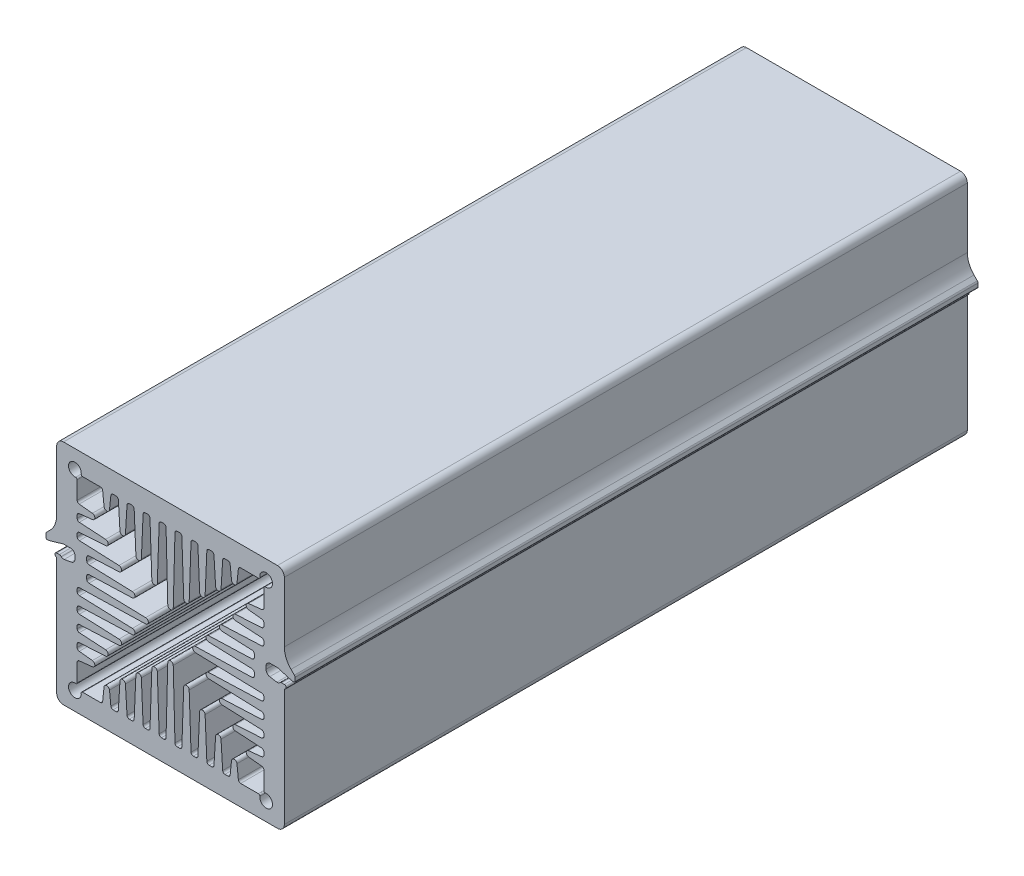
SolidWorks part; units mm, degrees
ref_plane "Front Plane" through (0, 0, 0) normal (0, 0, 1) x (1, 0, 0)
ref_plane "Top Plane" through (0, 0, 0) normal (0, 1, 0) x (1, 0, 0)
ref_plane "Right Plane" through (0, 0, 0) normal (1, 0, 0) x (0, 0, -1)
ref_plane "Plane1" through (0, 0, 0) normal (0, 0, -1) x (-1, 0, 0)
sketch "Sketch1" plane through (0, 0, 0) normal (0, 0, -1) x (-1, 0, 0)
  line L0 (-44.3118, 45.5) -> (-40.3993, 45.5)
  line L1 (-39.902, 45.0523) -> (-39.5967, 42.1473)
  line L2 (-38.4033, 42.1473) -> (-38.098, 45.0523)
  line L3 (-37.6007, 45.5) -> (-36.9519, 45.5)
  line L4 (-36.4528, 45.0305) -> (-36.0989, 39.2434)
  line L5 (-34.9011, 39.2434) -> (-34.5472, 45.0305)
  line L6 (-34.0481, 45.5) -> (-33.4792, 45.5)
  line L7 (-32.9796, 45.0218) -> (-32.5994, 36.3138)
  line L8 (-31.4006, 36.3138) -> (-31.0204, 45.0218)
  line L9 (-30.5208, 45.5) -> (-30.0058, 45.5)
  line L10 (-29.5061, 45.0174) -> (-29.0996, 33.3791)
  line L11 (-27.9004, 33.3791) -> (-27.4939, 45.0174)
  line L12 (-26.9942, 45.5) -> (-26.4807, 45.5)
  line L13 (-25.9809, 45.0131) -> (-25.5998, 30.4593)
  line L14 (-24.4002, 30.4593) -> (-24.0191, 45.0131)
  line L15 (-23.5193, 45.5) -> (-23.0058, 45.5)
  line L16 (-22.5061, 45.0174) -> (-22.0996, 33.3791)
  line L17 (-20.9004, 33.3791) -> (-20.4939, 45.0174)
  line L18 (-19.9942, 45.5) -> (-19.4792, 45.5)
  line L19 (-18.9796, 45.0218) -> (-18.5994, 36.3138)
  line L20 (-17.4006, 36.3138) -> (-17.0204, 45.0218)
  line L21 (-16.5208, 45.5) -> (-15.9519, 45.5)
  line L22 (-15.4528, 45.0305) -> (-15.0989, 39.2434)
  line L23 (-13.9011, 39.2434) -> (-13.5472, 45.0305)
  line L24 (-13.0481, 45.5) -> (-12.3993, 45.5)
  line L25 (-11.902, 45.0523) -> (-11.5967, 42.1473)
  line L26 (-10.4033, 42.1473) -> (-10.098, 45.0523)
  line L27 (-9.6007, 45.5) -> (-5.6882, 45.5)
  line L28 (-4.5, 44.3118) -> (-4.5, 40.3982)
  line L29 (-4.9477, 39.901) -> (-7.8427, 39.5967)
  line L30 (-7.8427, 38.4033) -> (-4.9477, 38.099)
  line L31 (-4.5, 37.6018) -> (-4.5, 36.9519)
  line L32 (-4.9695, 36.4528) -> (-10.7566, 36.0989)
  line L33 (-10.7566, 34.9011) -> (-4.9695, 34.5472)
  line L34 (-4.5, 34.0481) -> (-4.5, 33.4792)
  line L35 (-4.9782, 32.9796) -> (-13.6862, 32.5994)
  line L36 (-13.6862, 31.4006) -> (-7.0782, 31.1121)
  line L37 (-6.6, 30.6125) -> (-6.6, 29.9324)
  line L38 (-7.0826, 29.4327) -> (-16.6209, 29.0996)
  line L39 (-16.6209, 27.9004) -> (-7.0826, 27.5673)
  line L40 (-6.6, 27.0676) -> (-6.6, 26.4257)
  line L41 (-7.0869, 25.9259) -> (-19.5407, 25.5998)
  line L42 (-19.5407, 24.4002) -> (-4.9869, 24.0191)
  line L43 (-4.5, 23.5193) -> (-4.5, 23.0058)
  line L44 (-4.9826, 22.5061) -> (-16.6209, 22.0996)
  line L45 (-16.6209, 20.9004) -> (-4.9826, 20.4939)
  line L46 (-4.5, 19.9942) -> (-4.5, 19.4792)
  line L47 (-4.9782, 18.9796) -> (-13.6862, 18.5994)
  line L48 (-13.6862, 17.4006) -> (-4.9782, 17.0204)
  line L49 (-4.5, 16.5208) -> (-4.5, 15.9519)
  line L50 (-4.9695, 15.4528) -> (-10.7566, 15.0989)
  line L51 (-10.7566, 13.9011) -> (-4.9695, 13.5472)
  line L52 (-4.5, 13.0481) -> (-4.5, 12.3982)
  line L53 (-4.9477, 11.901) -> (-7.8427, 11.5967)
  line L54 (-7.8427, 10.4033) -> (-4.9477, 10.099)
  line L55 (-4.5, 9.6018) -> (-4.5, 5.6882)
  line L56 (-5.6882, 4.5) -> (-9.6007, 4.5)
  line L57 (-10.098, 4.9477) -> (-10.4033, 7.8527)
  line L58 (-11.5967, 7.8527) -> (-11.902, 4.9477)
  line L59 (-12.3993, 4.5) -> (-13.0481, 4.5)
  line L60 (-13.5472, 4.9695) -> (-13.9011, 10.7566)
  line L61 (-15.0989, 10.7566) -> (-15.4528, 4.9695)
  line L62 (-15.9519, 4.5) -> (-16.5208, 4.5)
  line L63 (-17.0204, 4.9782) -> (-17.4006, 13.6862)
  line L64 (-18.5994, 13.6862) -> (-18.9796, 4.9782)
  line L65 (-19.4792, 4.5) -> (-19.9942, 4.5)
  line L66 (-20.4939, 4.9826) -> (-20.9004, 16.6209)
  line L67 (-22.0996, 16.6209) -> (-22.5061, 4.9826)
  line L68 (-23.0058, 4.5) -> (-23.5193, 4.5)
  line L69 (-24.0191, 4.9869) -> (-24.4002, 19.5407)
  line L70 (-25.5998, 19.5407) -> (-25.9809, 4.9869)
  line L71 (-26.4807, 4.5) -> (-26.9942, 4.5)
  line L72 (-27.4939, 4.9826) -> (-27.9004, 16.6209)
  line L73 (-29.0996, 16.6209) -> (-29.5061, 4.9826)
  line L74 (-30.0058, 4.5) -> (-30.5208, 4.5)
  line L75 (-31.0204, 4.9782) -> (-31.4006, 13.6862)
  line L76 (-32.5994, 13.6862) -> (-32.9796, 4.9782)
  line L77 (-33.4792, 4.5) -> (-34.0481, 4.5)
  line L78 (-34.5472, 4.9695) -> (-34.9011, 10.7566)
  line L79 (-36.0989, 10.7566) -> (-36.4528, 4.9695)
  line L80 (-36.9519, 4.5) -> (-37.6007, 4.5)
  line L81 (-38.098, 4.9477) -> (-38.4033, 7.8527)
  line L82 (-39.5967, 7.8527) -> (-39.902, 4.9477)
  line L83 (-40.3993, 4.5) -> (-44.3118, 4.5)
  line L84 (-45.5, 5.6882) -> (-45.5, 9.6018)
  line L85 (-45.0523, 10.099) -> (-42.1573, 10.4033)
  line L86 (-42.1573, 11.5967) -> (-45.0523, 11.901)
  line L87 (-45.5, 12.3982) -> (-45.5, 13.0481)
  line L88 (-45.0305, 13.5472) -> (-39.2434, 13.9011)
  line L89 (-39.2434, 15.0989) -> (-45.0305, 15.4528)
  line L90 (-45.5, 15.9519) -> (-45.5, 16.5208)
  line L91 (-45.0218, 17.0204) -> (-36.3138, 17.4006)
  line L92 (-36.3138, 18.5994) -> (-45.0218, 18.9796)
  line L93 (-45.5, 19.4792) -> (-45.5, 19.9942)
  line L94 (-45.0174, 20.4939) -> (-33.3791, 20.9004)
  line L95 (-33.3791, 22.0996) -> (-45.0174, 22.5061)
  line L96 (-45.5, 23.0058) -> (-45.5, 23.5193)
  line L97 (-45.0131, 24.0191) -> (-30.4593, 24.4002)
  line L98 (-30.4593, 25.5998) -> (-42.9131, 25.9259)
  line L99 (-43.4, 26.4257) -> (-43.4, 27.0676)
  line L100 (-42.9174, 27.5673) -> (-33.3791, 27.9004)
  line L101 (-33.3791, 29.0996) -> (-42.9174, 29.4327)
  line L102 (-43.4, 29.9324) -> (-43.4, 30.6125)
  line L103 (-42.9218, 31.1121) -> (-36.3138, 31.4006)
  line L104 (-36.3138, 32.5994) -> (-45.0218, 32.9796)
  line L105 (-45.5, 33.4792) -> (-45.5, 34.0481)
  line L106 (-45.0305, 34.5472) -> (-39.2434, 34.9011)
  line L107 (-39.2434, 36.0989) -> (-45.0305, 36.4528)
  line L108 (-45.5, 36.9519) -> (-45.5, 37.6018)
  line L109 (-45.0523, 38.099) -> (-42.1573, 38.4033)
  line L110 (-42.1573, 39.5967) -> (-45.0523, 39.901)
  line L111 (-45.5, 40.3982) -> (-45.5, 44.3118)
  line L112 (0, 35.2698) -> (0, 48.5)
  line L113 (-1.5, 50) -> (-48.5, 50)
  line L114 (-50, 48.5) -> (-50, 35.2698)
  line L115 (-51.4645, 31.7342) -> (-52.198, 31.0007)
  line L116 (-52.3445, 30.6471) -> (-52.3445, 29.8471)
  line L117 (-52.1445, 29.6471) -> (-51.8577, 29.6471)
  line L118 (-51.5773, 29.6872) -> (-48.6415, 30.545)
  line L119 (-48.3611, 30.5851) -> (-46.9692, 30.5851)
  line L120 (-45.9692, 29.5851) -> (-45.9692, 28.9873)
  line L121 (-46.7985, 28.002) -> (-48.351, 27.7331)
  line L122 (-49.4124, 28.1325) -> (-50, 28.1325)
  line L123 (-50, 27.1) -> (-50, 1.5)
  line L124 (-48.5, 0) -> (-1.5, 0)
  line L125 (0, 1.5) -> (0, 27.1)
  line L126 (0, 28.1325) -> (-0.5876, 28.1325)
  line L127 (-1.649, 27.7331) -> (-3.2015, 28.002)
  line L128 (-4.0308, 28.9873) -> (-4.0308, 29.5851)
  line L129 (-3.0308, 30.5851) -> (-1.6389, 30.5851)
  line L130 (-1.3585, 30.545) -> (1.5773, 29.6872)
  line L131 (1.8577, 29.6471) -> (2.1445, 29.6471)
  line L132 (2.3445, 29.8471) -> (2.3445, 30.6471)
  line L133 (2.198, 31.0007) -> (1.4645, 31.7342)
  arc A0 (-45.8353, 44.6097) -> (-44.6097, 45.8353) centre (-46, 46) cw
  arc A1 (-44.6097, 45.8353) -> (-44.3118, 45.5) centre (-44.3118, 45.8) ccw
  arc A2 (-40.3993, 45.5) -> (-39.902, 45.0523) centre (-40.3993, 45) cw
  arc A3 (-39.5967, 42.1473) -> (-38.4033, 42.1473) centre (-39, 42.21) ccw
  arc A4 (-38.098, 45.0523) -> (-37.6007, 45.5) centre (-37.6007, 45) cw
  arc A5 (-36.9519, 45.5) -> (-36.4528, 45.0305) centre (-36.9519, 45) cw
  arc A6 (-36.0989, 39.2434) -> (-34.9011, 39.2434) centre (-35.5, 39.28) ccw
  arc A7 (-34.5472, 45.0305) -> (-34.0481, 45.5) centre (-34.0481, 45) cw
  arc A8 (-33.4792, 45.5) -> (-32.9796, 45.0218) centre (-33.4792, 45) cw
  arc A9 (-32.5994, 36.3138) -> (-31.4006, 36.3138) centre (-32, 36.34) ccw
  arc A10 (-31.0204, 45.0218) -> (-30.5208, 45.5) centre (-30.5208, 45) cw
  arc A11 (-30.0058, 45.5) -> (-29.5061, 45.0174) centre (-30.0058, 45) cw
  arc A12 (-29.0996, 33.3791) -> (-27.9004, 33.3791) centre (-28.5, 33.4) ccw
  arc A13 (-27.4939, 45.0174) -> (-26.9942, 45.5) centre (-26.9942, 45) cw
  arc A14 (-26.4807, 45.5) -> (-25.9809, 45.0131) centre (-26.4807, 45) cw
  arc A15 (-25.5998, 30.4593) -> (-24.4002, 30.4593) centre (-25, 30.475) ccw
  arc A16 (-24.0191, 45.0131) -> (-23.5193, 45.5) centre (-23.5193, 45) cw
  arc A17 (-23.0058, 45.5) -> (-22.5061, 45.0174) centre (-23.0058, 45) cw
  arc A18 (-22.0996, 33.3791) -> (-20.9004, 33.3791) centre (-21.5, 33.4) ccw
  arc A19 (-20.4939, 45.0174) -> (-19.9942, 45.5) centre (-19.9942, 45) cw
  arc A20 (-19.4792, 45.5) -> (-18.9796, 45.0218) centre (-19.4792, 45) cw
  arc A21 (-18.5994, 36.3138) -> (-17.4006, 36.3138) centre (-18, 36.34) ccw
  arc A22 (-17.0204, 45.0218) -> (-16.5208, 45.5) centre (-16.5208, 45) cw
  arc A23 (-15.9519, 45.5) -> (-15.4528, 45.0305) centre (-15.9519, 45) cw
  arc A24 (-15.0989, 39.2434) -> (-13.9011, 39.2434) centre (-14.5, 39.28) ccw
  arc A25 (-13.5472, 45.0305) -> (-13.0481, 45.5) centre (-13.0481, 45) cw
  arc A26 (-12.3993, 45.5) -> (-11.902, 45.0523) centre (-12.3993, 45) cw
  arc A27 (-11.5967, 42.1473) -> (-10.4033, 42.1473) centre (-11, 42.21) ccw
  arc A28 (-10.098, 45.0523) -> (-9.6007, 45.5) centre (-9.6007, 45) cw
  arc A29 (-5.6882, 45.5) -> (-5.3903, 45.8353) centre (-5.6882, 45.8) ccw
  arc A30 (-5.3903, 45.8353) -> (-4.1647, 44.6097) centre (-4, 46) cw
  arc A31 (-4.1647, 44.6097) -> (-4.5, 44.3118) centre (-4.2, 44.3118) ccw
  arc A32 (-4.5, 40.3982) -> (-4.9477, 39.901) centre (-5, 40.3982) cw
  arc A33 (-7.8427, 39.5967) -> (-7.8427, 38.4033) centre (-7.78, 39) ccw
  arc A34 (-4.9477, 38.099) -> (-4.5, 37.6018) centre (-5, 37.6018) cw
  arc A35 (-4.5, 36.9519) -> (-4.9695, 36.4528) centre (-5, 36.9519) cw
  arc A36 (-10.7566, 36.0989) -> (-10.7566, 34.9011) centre (-10.72, 35.5) ccw
  arc A37 (-4.9695, 34.5472) -> (-4.5, 34.0481) centre (-5, 34.0481) cw
  arc A38 (-4.5, 33.4792) -> (-4.9782, 32.9796) centre (-5, 33.4792) cw
  arc A39 (-13.6862, 32.5994) -> (-13.6862, 31.4006) centre (-13.66, 32) ccw
  arc A40 (-7.0782, 31.1121) -> (-6.6, 30.6125) centre (-7.1, 30.6125) cw
  arc A41 (-6.6, 29.9324) -> (-7.0826, 29.4327) centre (-7.1, 29.9324) cw
  arc A42 (-16.6209, 29.0996) -> (-16.6209, 27.9004) centre (-16.6, 28.5) ccw
  arc A43 (-7.0826, 27.5673) -> (-6.6, 27.0676) centre (-7.1, 27.0676) cw
  arc A44 (-6.6, 26.4257) -> (-7.0869, 25.9259) centre (-7.1, 26.4257) cw
  arc A45 (-19.5407, 25.5998) -> (-19.5407, 24.4002) centre (-19.525, 25) ccw
  arc A46 (-4.9869, 24.0191) -> (-4.5, 23.5193) centre (-5, 23.5193) cw
  arc A47 (-4.5, 23.0058) -> (-4.9826, 22.5061) centre (-5, 23.0058) cw
  arc A48 (-16.6209, 22.0996) -> (-16.6209, 20.9004) centre (-16.6, 21.5) ccw
  arc A49 (-4.9826, 20.4939) -> (-4.5, 19.9942) centre (-5, 19.9942) cw
  arc A50 (-4.5, 19.4792) -> (-4.9782, 18.9796) centre (-5, 19.4792) cw
  arc A51 (-13.6862, 18.5994) -> (-13.6862, 17.4006) centre (-13.66, 18) ccw
  arc A52 (-4.9782, 17.0204) -> (-4.5, 16.5208) centre (-5, 16.5208) cw
  arc A53 (-4.5, 15.9519) -> (-4.9695, 15.4528) centre (-5, 15.9519) cw
  arc A54 (-10.7566, 15.0989) -> (-10.7566, 13.9011) centre (-10.72, 14.5) ccw
  arc A55 (-4.9695, 13.5472) -> (-4.5, 13.0481) centre (-5, 13.0481) cw
  arc A56 (-4.5, 12.3982) -> (-4.9477, 11.901) centre (-5, 12.3982) cw
  arc A57 (-7.8427, 11.5967) -> (-7.8427, 10.4033) centre (-7.78, 11) ccw
  arc A58 (-4.9477, 10.099) -> (-4.5, 9.6018) centre (-5, 9.6018) cw
  arc A59 (-4.5, 5.6882) -> (-4.1647, 5.3903) centre (-4.2, 5.6882) ccw
  arc A60 (-4.1647, 5.3903) -> (-5.3903, 4.1647) centre (-4, 4) cw
  arc A61 (-5.3903, 4.1647) -> (-5.6882, 4.5) centre (-5.6882, 4.2) ccw
  arc A62 (-9.6007, 4.5) -> (-10.098, 4.9477) centre (-9.6007, 5) cw
  arc A63 (-10.4033, 7.8527) -> (-11.5967, 7.8527) centre (-11, 7.79) ccw
  arc A64 (-11.902, 4.9477) -> (-12.3993, 4.5) centre (-12.3993, 5) cw
  arc A65 (-13.0481, 4.5) -> (-13.5472, 4.9695) centre (-13.0481, 5) cw
  arc A66 (-13.9011, 10.7566) -> (-15.0989, 10.7566) centre (-14.5, 10.72) ccw
  arc A67 (-15.4528, 4.9695) -> (-15.9519, 4.5) centre (-15.9519, 5) cw
  arc A68 (-16.5208, 4.5) -> (-17.0204, 4.9782) centre (-16.5208, 5) cw
  arc A69 (-17.4006, 13.6862) -> (-18.5994, 13.6862) centre (-18, 13.66) ccw
  arc A70 (-18.9796, 4.9782) -> (-19.4792, 4.5) centre (-19.4792, 5) cw
  arc A71 (-19.9942, 4.5) -> (-20.4939, 4.9826) centre (-19.9942, 5) cw
  arc A72 (-20.9004, 16.6209) -> (-22.0996, 16.6209) centre (-21.5, 16.6) ccw
  arc A73 (-22.5061, 4.9826) -> (-23.0058, 4.5) centre (-23.0058, 5) cw
  arc A74 (-23.5193, 4.5) -> (-24.0191, 4.9869) centre (-23.5193, 5) cw
  arc A75 (-24.4002, 19.5407) -> (-25.5998, 19.5407) centre (-25, 19.525) ccw
  arc A76 (-25.9809, 4.9869) -> (-26.4807, 4.5) centre (-26.4807, 5) cw
  arc A77 (-26.9942, 4.5) -> (-27.4939, 4.9826) centre (-26.9942, 5) cw
  arc A78 (-27.9004, 16.6209) -> (-29.0996, 16.6209) centre (-28.5, 16.6) ccw
  arc A79 (-29.5061, 4.9826) -> (-30.0058, 4.5) centre (-30.0058, 5) cw
  arc A80 (-30.5208, 4.5) -> (-31.0204, 4.9782) centre (-30.5208, 5) cw
  arc A81 (-31.4006, 13.6862) -> (-32.5994, 13.6862) centre (-32, 13.66) ccw
  arc A82 (-32.9796, 4.9782) -> (-33.4792, 4.5) centre (-33.4792, 5) cw
  arc A83 (-34.0481, 4.5) -> (-34.5472, 4.9695) centre (-34.0481, 5) cw
  arc A84 (-34.9011, 10.7566) -> (-36.0989, 10.7566) centre (-35.5, 10.72) ccw
  arc A85 (-36.4528, 4.9695) -> (-36.9519, 4.5) centre (-36.9519, 5) cw
  arc A86 (-37.6007, 4.5) -> (-38.098, 4.9477) centre (-37.6007, 5) cw
  arc A87 (-38.4033, 7.8527) -> (-39.5967, 7.8527) centre (-39, 7.79) ccw
  arc A88 (-39.902, 4.9477) -> (-40.3993, 4.5) centre (-40.3993, 5) cw
  arc A89 (-44.3118, 4.5) -> (-44.6097, 4.1647) centre (-44.3118, 4.2) ccw
  arc A90 (-44.6097, 4.1647) -> (-45.8353, 5.3903) centre (-46, 4) cw
  arc A91 (-45.8353, 5.3903) -> (-45.5, 5.6882) centre (-45.8, 5.6882) ccw
  arc A92 (-45.5, 9.6018) -> (-45.0523, 10.099) centre (-45, 9.6018) cw
  arc A93 (-42.1573, 10.4033) -> (-42.1573, 11.5967) centre (-42.22, 11) ccw
  arc A94 (-45.0523, 11.901) -> (-45.5, 12.3982) centre (-45, 12.3982) cw
  arc A95 (-45.5, 13.0481) -> (-45.0305, 13.5472) centre (-45, 13.0481) cw
  arc A96 (-39.2434, 13.9011) -> (-39.2434, 15.0989) centre (-39.28, 14.5) ccw
  arc A97 (-45.0305, 15.4528) -> (-45.5, 15.9519) centre (-45, 15.9519) cw
  arc A98 (-45.5, 16.5208) -> (-45.0218, 17.0204) centre (-45, 16.5208) cw
  arc A99 (-36.3138, 17.4006) -> (-36.3138, 18.5994) centre (-36.34, 18) ccw
  arc A100 (-45.0218, 18.9796) -> (-45.5, 19.4792) centre (-45, 19.4792) cw
  arc A101 (-45.5, 19.9942) -> (-45.0174, 20.4939) centre (-45, 19.9942) cw
  arc A102 (-33.3791, 20.9004) -> (-33.3791, 22.0996) centre (-33.4, 21.5) ccw
  arc A103 (-45.0174, 22.5061) -> (-45.5, 23.0058) centre (-45, 23.0058) cw
  arc A104 (-45.5, 23.5193) -> (-45.0131, 24.0191) centre (-45, 23.5193) cw
  arc A105 (-30.4593, 24.4002) -> (-30.4593, 25.5998) centre (-30.475, 25) ccw
  arc A106 (-42.9131, 25.9259) -> (-43.4, 26.4257) centre (-42.9, 26.4257) cw
  arc A107 (-43.4, 27.0676) -> (-42.9174, 27.5673) centre (-42.9, 27.0676) cw
  arc A108 (-33.3791, 27.9004) -> (-33.3791, 29.0996) centre (-33.4, 28.5) ccw
  arc A109 (-42.9174, 29.4327) -> (-43.4, 29.9324) centre (-42.9, 29.9324) cw
  arc A110 (-43.4, 30.6125) -> (-42.9218, 31.1121) centre (-42.9, 30.6125) cw
  arc A111 (-36.3138, 31.4006) -> (-36.3138, 32.5994) centre (-36.34, 32) ccw
  arc A112 (-45.0218, 32.9796) -> (-45.5, 33.4792) centre (-45, 33.4792) cw
  arc A113 (-45.5, 34.0481) -> (-45.0305, 34.5472) centre (-45, 34.0481) cw
  arc A114 (-39.2434, 34.9011) -> (-39.2434, 36.0989) centre (-39.28, 35.5) ccw
  arc A115 (-45.0305, 36.4528) -> (-45.5, 36.9519) centre (-45, 36.9519) cw
  arc A116 (-45.5, 37.6018) -> (-45.0523, 38.099) centre (-45, 37.6018) cw
  arc A117 (-42.1573, 38.4033) -> (-42.1573, 39.5967) centre (-42.22, 39) ccw
  arc A118 (-45.0523, 39.901) -> (-45.5, 40.3982) centre (-45, 40.3982) cw
  arc A119 (-45.5, 44.3118) -> (-45.8353, 44.6097) centre (-45.8, 44.3118) ccw
  arc A120 (1.4645, 31.7342) -> (0, 35.2698) centre (5, 35.2698) cw
  arc A121 (0, 48.5) -> (-1.5, 50) centre (-1.5, 48.5) ccw
  arc A122 (-48.5, 50) -> (-50, 48.5) centre (-48.5, 48.5) ccw
  arc A123 (-50, 35.2698) -> (-51.4645, 31.7342) centre (-55, 35.2698) cw
  arc A124 (-52.198, 31.0007) -> (-52.3445, 30.6471) centre (-51.8445, 30.6471) ccw
  arc A125 (-52.3445, 29.8471) -> (-52.1445, 29.6471) centre (-52.1445, 29.8471) ccw
  arc A126 (-51.8577, 29.6471) -> (-51.5773, 29.6872) centre (-51.8577, 30.6471) ccw
  arc A127 (-48.6415, 30.545) -> (-48.3611, 30.5851) centre (-48.3611, 29.5851) cw
  arc A128 (-46.9692, 30.5851) -> (-45.9692, 29.5851) centre (-46.9692, 29.5851) cw
  arc A129 (-45.9692, 28.9873) -> (-46.7985, 28.002) centre (-46.9692, 28.9873) cw
  arc A130 (-48.351, 27.7331) -> (-48.9825, 27.9455) centre (-48.4705, 28.4228) cw
  arc A131 (-48.9825, 27.9455) -> (-49.4124, 28.1325) centre (-49.4124, 27.5448) ccw
  arc A132 (-50, 28.1325) -> (-50.1714, 27.3711) centre (-50, 27.7325) ccw
  arc A133 (-50.1714, 27.3711) -> (-50, 27.1) centre (-50.3, 27.1) cw
  arc A134 (-50, 1.5) -> (-48.5, 0) centre (-48.5, 1.5) ccw
  arc A135 (-1.5, 0) -> (0, 1.5) centre (-1.5, 1.5) ccw
  arc A136 (0, 27.1) -> (0.1714, 27.3711) centre (0.3, 27.1) cw
  arc A137 (0.1714, 27.3711) -> (0, 28.1325) centre (0, 27.7325) ccw
  arc A138 (-0.5876, 28.1325) -> (-1.0175, 27.9455) centre (-0.5876, 27.5448) ccw
  arc A139 (-1.0175, 27.9455) -> (-1.649, 27.7331) centre (-1.5295, 28.4228) cw
  arc A140 (-3.2015, 28.002) -> (-4.0308, 28.9873) centre (-3.0308, 28.9873) cw
  arc A141 (-4.0308, 29.5851) -> (-3.0308, 30.5851) centre (-3.0308, 29.5851) cw
  arc A142 (-1.6389, 30.5851) -> (-1.3585, 30.545) centre (-1.6389, 29.5851) cw
  arc A143 (1.5773, 29.6872) -> (1.8577, 29.6471) centre (1.8577, 30.6471) ccw
  arc A144 (2.1445, 29.6471) -> (2.3445, 29.8471) centre (2.1445, 29.8471) ccw
  arc A145 (2.3445, 30.6471) -> (2.198, 31.0007) centre (1.8445, 30.6471) ccw
extrude "Boss-Extrude1" add sketch "Sketch1" against normal blind 150
